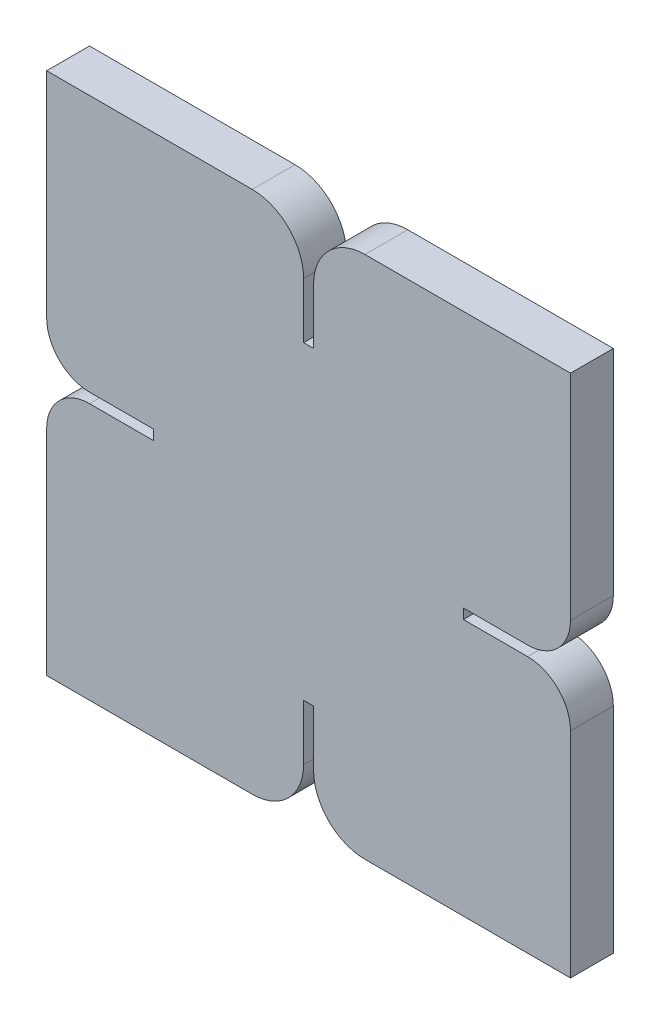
SolidWorks part; units mm, degrees
ref_plane "Front Plane" through (0, 0, 0) normal (0, 0, 1) x (1, 0, 0)
ref_plane "Top Plane" through (0, 0, 0) normal (0, 1, 0) x (1, 0, 0)
ref_plane "Right Plane" through (0, 0, 0) normal (1, 0, 0) x (0, 0, -1)
sketch "Sketch1" plane through (0, 0, 0) normal (0, 0, 1) x (1, 0, 0)
  line L0 (0, 56.5994) -> (0, -33.9185) construction
  line L1 (1.1667, 36.1667) -> (1.1667, 49.1667)
  line L2 (-36.1667, 1.1667) -> (-36.1667, -1.1667)
  line L3 (-1.1667, 36.1667) -> (1.1667, 36.1667)
  line L4 (61.1667, 61.1667) -> (13.1667, 61.1667)
  line L5 (61.1667, 11.1667) -> (61.1667, 61.1667)
  line L6 (51.1667, 1.1667) -> (36.1667, 1.1667)
  line L7 (-51.1667, 1.1667) -> (-36.1667, 1.1667)
  line L8 (-61.1667, 11.1667) -> (-61.1667, 61.1667)
  line L9 (-61.1667, 61.1667) -> (-13.1667, 61.1667)
  line L10 (-1.1667, 36.1667) -> (-1.1667, 49.1667)
  line L11 (36.1667, 1.1667) -> (36.1667, -1.1667)
  line L12 (-1.1667, -36.1667) -> (-1.1667, -49.1667)
  line L13 (-61.1667, -61.1667) -> (-13.1667, -61.1667)
  line L14 (-61.1667, -11.1667) -> (-61.1667, -61.1667)
  line L15 (-51.1667, -1.1667) -> (-36.1667, -1.1667)
  line L16 (51.1667, -1.1667) -> (36.1667, -1.1667)
  line L17 (61.1667, -11.1667) -> (61.1667, -61.1667)
  line L18 (61.1667, -61.1667) -> (13.1667, -61.1667)
  line L19 (-47.3502, 0) -> (63.8446, 0) construction
  line L20 (-1.1667, -36.1667) -> (1.1667, -36.1667)
  line L21 (1.1667, -36.1667) -> (1.1667, -49.1667)
  arc A0 (-1.1667, 49.1667) -> (-13.1667, 61.1667) centre (-13.1667, 49.1667) ccw
  arc A1 (51.1667, 1.1667) -> (61.1667, 11.1667) centre (51.1667, 11.1667) ccw
  arc A2 (1.1667, 49.1667) -> (13.1667, 61.1667) centre (13.1667, 49.1667) cw
  arc A3 (-51.1667, -1.1667) -> (-61.1667, -11.1667) centre (-51.1667, -11.1667) ccw
  arc A4 (1.1667, -49.1667) -> (13.1667, -61.1667) centre (13.1667, -49.1667) ccw
  arc A5 (51.1667, -1.1667) -> (61.1667, -11.1667) centre (51.1667, -11.1667) cw
  arc A6 (-51.1667, 1.1667) -> (-61.1667, 11.1667) centre (-51.1667, 11.1667) cw
  arc A7 (-1.1667, -49.1667) -> (-13.1667, -61.1667) centre (-13.1667, -49.1667) cw
  point P0 (0, 0)
  point P3 (-1.1667, 61.1667)
  point P10 (-156.0365, -11.2807)
  point P12 (-156.0365, -11.2807)
  point P13 (-133.044, -4.2512)
  point P18 (-121.9935, -11.2807)
  point P27 (0, 36.1667)
  point P29 (61.1667, 1.1667)
  point P30 (61.1667, -1.1667)
  point P44 (36.1667, 0)
  point P47 (-61.1667, -1.1667)
  point P50 (-61.1667, 1.1667)
  point P53 (1.1667, 61.1667)
  point P54 (-36.1667, 0)
  point P55 (1.1667, -61.1667)
  point P56 (0, -36.1667)
  point P57 (-1.1667, -61.1667)
extrude "Boss-Extrude1" add sketch "Sketch1" along normal blind 10
equation "\"D1@Sketch1\"=\"A\""
equation "\"A\"= 60"
equation "\"D2@Sketch1\"=\"A\""
equation "\"D5@Sketch1\"=\"A\"/5"
equation "\"D3@Sketch1\"=70/\"A\""
equation "\"D7@Sketch1\"=70/\"A\"'"
